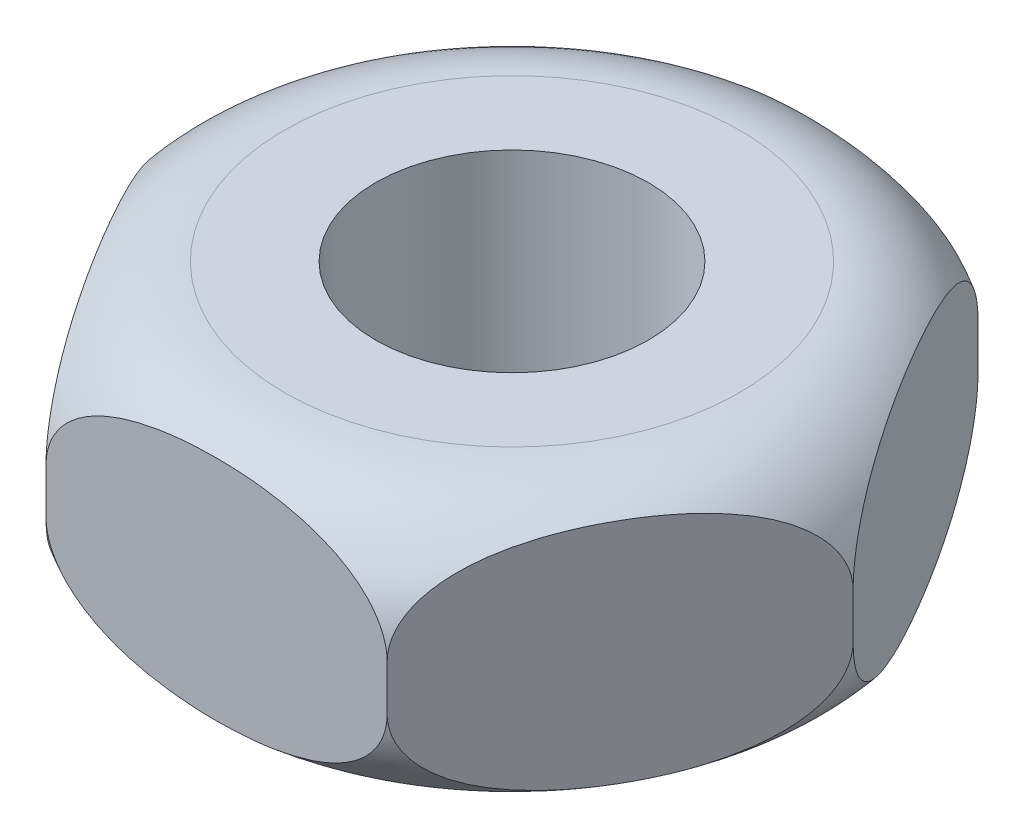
SolidWorks part; units mm, degrees
ref_plane "Front" through (0, 0, 0) normal (0, 0, 1) x (1, 0, 0)
ref_plane "Top" through (0, 0, 0) normal (0, 1, 0) x (1, 0, 0)
ref_plane "Right" through (0, 0, 0) normal (1, 0, 0) x (0, 0, -1)
sketch "Sketch1" plane through (0, 0, 0) normal (0, 1, 0) x (1, 0, 0)
  line L1 (15, 0) -> (7.5, 12.9904)
  line L2 (7.5, 12.9904) -> (-7.5, 12.9904)
  line L3 (-7.5, 12.9904) -> (-15, 0)
  line L4 (-15, 0) -> (-7.5, -12.9904)
  line L5 (-7.5, -12.9904) -> (7.5, -12.9904)
  line L6 (7.5, -12.9904) -> (15, 0)
  circle A0 centre (0, 0) radius 12.9904 construction
  circle A1 centre (0, 0) radius 6
  dimension "D2" = 12
  dimension "D1" = 30
extrude "Extrude1" add sketch "Sketch1" along normal blind 12
sketch "Sketch2" plane through (0, 0, 0) normal (0, 0, 1) x (1, 0, 0)
  line L0 (-15, 6) -> (15, 6) construction
  line L1 (0, 15.2412) -> (0, -3.9853) construction
  line L2 (-15, 12) -> (-15, 0) construction
  line L3 (15, 12) -> (15, 0) construction
  line L4 (10, 12) -> (10, 17.0024)
  line L5 (10, 17.0024) -> (18.0043, 17.0024)
  line L6 (18.0043, 17.0024) -> (18.0043, 7)
  line L7 (18.0043, 7) -> (15, 7)
  line L10 (18.0043, 5) -> (15, 5)
  line L11 (18.0043, -5.0024) -> (18.0043, 5)
  line L12 (10, -5.0024) -> (18.0043, -5.0024)
  line L13 (10, 0) -> (10, -5.0024)
  arc A0 (15, 7) -> (10, 12) centre (10, 7) ccw
  arc A1 (15, 5) -> (10, 0) centre (10, 5) cw
  dimension "D1" = 5
revolve "Cut-Revolve1" cut sketch "Sketch2" angle 360 about L1
